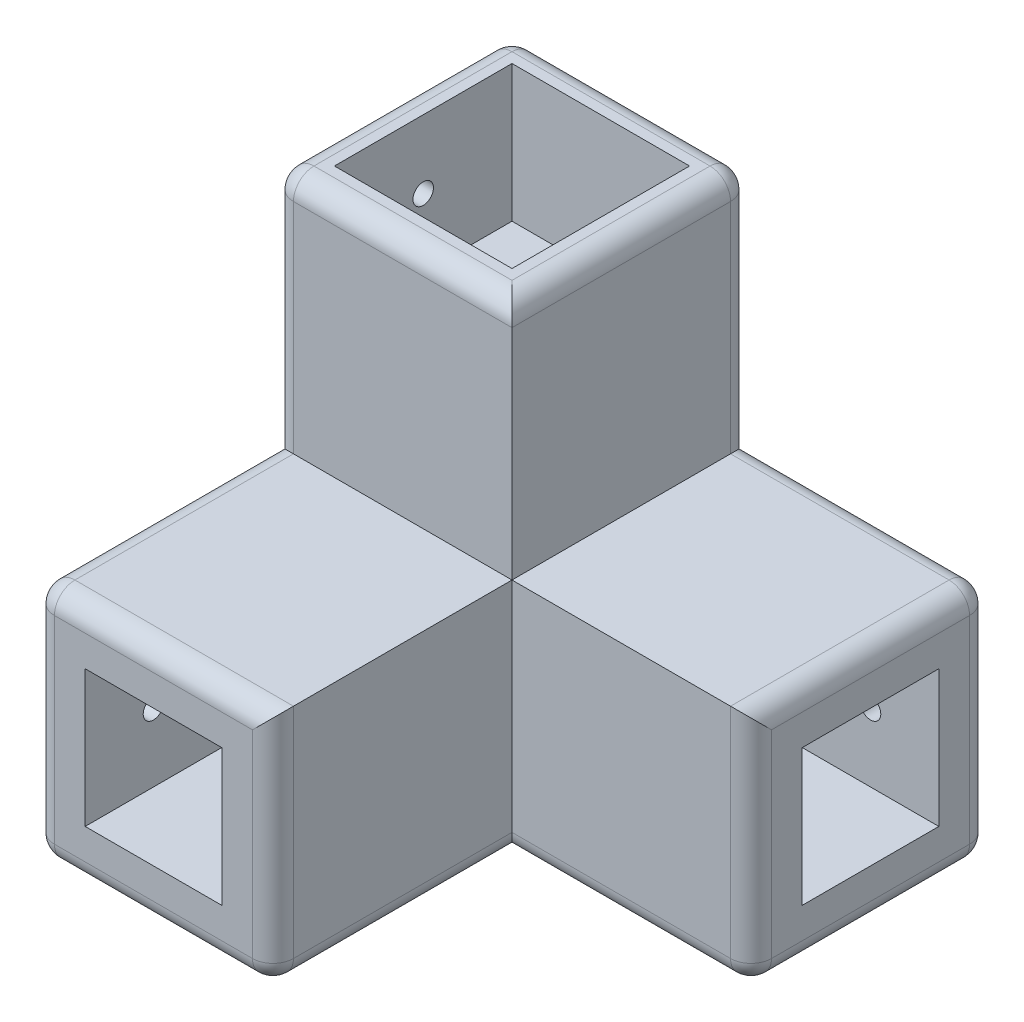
SolidWorks part; units mm, degrees
ref_plane "Alzado" through (0, 0, 0) normal (0, 0, 1) x (1, 0, 0)
ref_plane "Planta" through (0, 0, 0) normal (0, 1, 0) x (1, 0, 0)
ref_plane "Vista lateral" through (0, 0, 0) normal (1, 0, 0) x (0, 0, -1)
sketch "Sketch1" plane through (0, 0, 0) normal (0, 0, 1) x (1, 0, 0)
  line L0 (0, 70) -> (0, 0)
  line L1 (0, 0) -> (70, 0)
  line L2 (70, 0) -> (70, 35)
  line L3 (70, 35) -> (35, 35)
  line L4 (35, 35) -> (35, 70)
  line L5 (35, 70) -> (0, 70)
  dimension "D1" = 70
  dimension "D2" = 70
  dimension "D3" = 35
  dimension "D4" = 35
extrude "Boss-Extrude1" add sketch "Sketch1" along normal blind 35
sketch "Sketch2" plane through (0, 0, 35) normal (0, 0, 1) x (1, 0, 0)
  line L0 (35, 35) -> (0, 35)
  line L1 (0, 70) -> (0, 0) construction
  line L2 (0, 35) -> (0, 0)
  line L3 (0, 0) -> (35, 0)
  line L4 (0, 0) -> (70, 0) construction
  line L5 (35, 0) -> (35, 35)
extrude "Boss-Extrude2" add sketch "Sketch2" along normal blind 35
sketch "Sketch3" plane through (0, 0, 70) normal (0, 0, 1) x (1, 0, 0)
  line L0 (35, 0) -> (35, 35) construction
  line L1 (7.5, 27.5) -> (27.5, 27.5)
  line L2 (7.5, 27.5) -> (7.5, 7.5)
  line L3 (7.5, 7.5) -> (27.5, 7.5)
  line L4 (27.5, 27.5) -> (27.5, 7.5)
  line L5 (7.5, 27.5) -> (27.5, 7.5) construction
  line L6 (7.5, 7.5) -> (27.5, 27.5) construction
  line L7 (0, 0) -> (35, 0) construction
  point P0 (17.5, 17.5)
  dimension "D1" = 17.5
  dimension "D2" = 17.5
  dimension "D3" = 20
  dimension "D4" = 20
sketch "Sketch4" plane through (70, 0, 0) normal (1, 0, 0) x (0, 0, -1)
  line L0 (0, 0) -> (0, 35) construction
  line L1 (-27.5, 27.5) -> (-7.5, 27.5)
  line L2 (-27.5, 27.5) -> (-27.5, 7.5)
  line L3 (-27.5, 7.5) -> (-7.5, 7.5)
  line L4 (-7.5, 27.5) -> (-7.5, 7.5)
  line L5 (-27.5, 27.5) -> (-7.5, 7.5) construction
  line L6 (-27.5, 7.5) -> (-7.5, 27.5) construction
  line L7 (-35, 0) -> (0, 0) construction
  point P0 (-17.5, 17.5)
  dimension "D1" = 20
  dimension "D2" = 20
  dimension "D3" = 17.5
  dimension "D4" = 17.5
sketch "Sketch5" plane through (0, 70, 0) normal (0, 1, 0) x (1, 0, 0)
  line L0 (35, 0) -> (0, 0) construction
  line L1 (4.5, -4.5) -> (30.5, -4.5)
  line L2 (4.5, -4.5) -> (4.5, -30.5)
  line L3 (4.5, -30.5) -> (30.5, -30.5)
  line L4 (30.5, -4.5) -> (30.5, -30.5)
  line L5 (4.5, -4.5) -> (30.5, -30.5) construction
  line L6 (4.5, -30.5) -> (30.5, -4.5) construction
  line L7 (35, -35) -> (35, 0) construction
  point P0 (17.5, -17.5)
  dimension "D1" = 26
  dimension "D2" = 26
  dimension "D3" = 17.5
  dimension "D4" = 17.5
extrude "Cut-Extrude1" cut sketch "Sketch3" against normal blind 20 contours L3 L4 L1 L2
extrude "Cut-Extrude2" cut sketch "Sketch4" against normal blind 20 contours L3 L4 L1 L2
extrude "Cut-Extrude3" cut sketch "Sketch5" against normal blind 20 contours L3 L4 L1 L2
fillet "Fillet1" radius 3 21 edges at (35, 0, 0) (70, 17.5, 0) (52.5, 35, 0) (35, 52.5, 0) (17.5, 70, 0) (35, 70, 17.5) (17.5, 70, 35) (17.5, 35, 70) (0, 0, 35) (0, 17.5, 70) (0, 35, 52.5) (0, 52.5, 35) (0, 70, 17.5) (0, 35, 0) (70, 35, 17.5) (70, 17.5, 35) (35, 17.5, 70) (70, 0, 17.5) (52.5, 0, 35) (35, 0, 52.5) (17.5, 0, 70)
sketch "Sketch7" plane through (0, 0, 0) normal (-1, 0, 0) x (0, 0, 1)
  line L1 (67, 0) -> (3, 0) construction
  line L2 (70, 32) -> (70, 3) construction
  line L3 (0, 3) -> (0, 67) construction
  line L4 (3, 70) -> (32, 70) construction
  circle A0 centre (60, 17.5) radius 1.5
  circle A1 centre (17.5, 60) radius 1.5
  dimension "D1" = 3
  dimension "D2" = 3
  dimension "D3" = 17.5
  dimension "D4" = 10
  dimension "D5" = 17.5
  dimension "D6" = 10
extrude "Cut-Extrude4" cut sketch "Sketch7" against normal blind 10
sketch "Sketch8" plane through (0, 0, 0) normal (0, 0, -1) x (-1, 0, 0)
  line L0 (-70, 3) -> (-70, 32) construction
  line L1 (-67, 35) -> (-35, 35) construction
  circle A0 centre (-60, 17.5) radius 1.5
  dimension "D1" = 3
  dimension "D2" = 10
  dimension "D3" = 17.5
extrude "Cut-Extrude5" cut sketch "Sketch8" against normal blind 10
